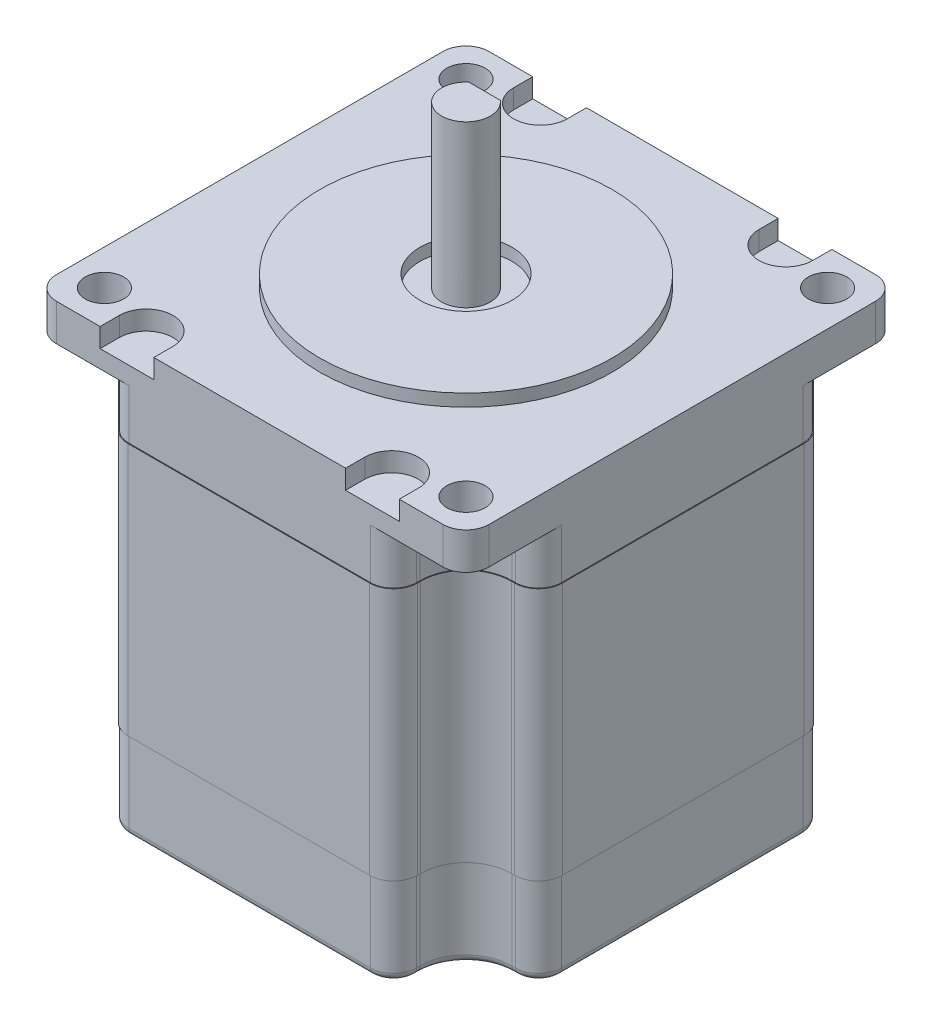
SolidWorks part; units mm, degrees
ref_plane "Front Plane" through (0, 0, 0) normal (0, 0, 1) x (1, 0, 0)
ref_plane "Top Plane" through (0, 0, 0) normal (0, 1, 0) x (1, 0, 0)
ref_plane "Right Plane" through (0, 0, 0) normal (1, 0, 0) x (0, 0, -1)
sketch "Sketch1" plane through (0, 0, 0) normal (0, 1, 0) x (1, 0, 0)
  line L5 (-28.2, 28.2) -> (28.2, 28.2)
  line L6 (-28.2, 28.2) -> (-28.2, -28.2)
  line L7 (-28.2, -28.2) -> (28.2, -28.2)
  line L8 (28.2, 28.2) -> (28.2, -28.2)
  line L9 (-28.2, 28.2) -> (28.2, -28.2) construction
  line L10 (-28.2, -28.2) -> (28.2, 28.2) construction
  point P0 (0, 0)
  dimension "D1" = 56.4
extrude "Boss-Extrude1" add sketch "Sketch1" along normal mid plane 55.8
sketch "Sketch2" plane through (0, 27.9, 0) normal (0, -1, 0) x (1, 0, 0)
  line L0 (-18.75, 28.2) -> (-18.75, 24.75)
  line L1 (-28.2, 28.2) -> (28.2, 28.2) construction
  line L2 (-24.75, 18.75) -> (-28.2, 18.75)
  line L3 (-28.2, -28.2) -> (-28.2, 28.2) construction
  line L4 (0, 0) -> (0, 28.2) construction
  line L5 (-18.75, 28.2) -> (-28.2, 28.2)
  line L6 (-28.2, 28.2) -> (-28.2, 18.75)
  line L7 (28.2, 28.2) -> (28.2, 18.75)
  line L8 (18.75, 28.2) -> (28.2, 28.2)
  line L9 (24.75, 18.75) -> (28.2, 18.75)
  line L10 (18.75, 28.2) -> (18.75, 24.75)
  line L11 (0, 0) -> (28.2, 0) construction
  line L12 (28.2, 28.2) -> (28.2, -28.2) construction
  line L13 (18.75, -28.2) -> (18.75, -24.75)
  line L14 (24.75, -18.75) -> (28.2, -18.75)
  line L15 (18.75, -28.2) -> (28.2, -28.2)
  line L16 (28.2, -28.2) -> (28.2, -18.75)
  line L17 (-28.2, -28.2) -> (-28.2, -18.75)
  line L18 (-18.75, -28.2) -> (-28.2, -28.2)
  line L19 (-24.75, -18.75) -> (-28.2, -18.75)
  line L20 (-18.75, -28.2) -> (-18.75, -24.75)
  arc A0 (-18.75, 24.75) -> (-24.75, 18.75) centre (-24.75, 24.75) cw
  arc A1 (18.75, 24.75) -> (24.75, 18.75) centre (24.75, 24.75) ccw
  arc A2 (18.75, -24.75) -> (24.75, -18.75) centre (24.75, -24.75) cw
  arc A3 (-18.75, -24.75) -> (-24.75, -18.75) centre (-24.75, -24.75) ccw
  dimension "D1" = 37.5
  dimension "D3" = 6
  dimension "D2" = 18.75
extrude "Cut-Extrude1" cut sketch "Sketch2" along normal through all from offset 4.8
fillet "Fillet1" radius 3 12 edges at (-28.2, -2.4, -18.75) (-28.2, -2.4, 18.75) (18.75, -2.4, 28.2) (28.2, -2.4, 18.75) (28.2, -2.4, -18.75) (18.75, -2.4, -28.2) (-18.75, -2.4, -28.2) (-18.75, -2.4, 28.2) (28.2, 25.5, 28.2) (-28.2, 25.5, -28.2) (28.2, 25.5, -28.2) (-28.2, 25.5, 28.2)
fillet "Fillet2" radius 1 24 edges at (-17.8713, -27.9, 27.3213) (-18.75, -27.9, 24.975) (-20.5074, -27.9, 20.5074) (-24.975, -27.9, 18.75) (-27.3213, -27.9, 17.8713) (-28.2, -27.9, 0) (-27.3213, -27.9, -17.8713) (-24.975, -27.9, -18.75) (-20.5074, -27.9, -20.5074) (-18.75, -27.9, -24.975) (-17.8713, -27.9, -27.3213) (0, -27.9, -28.2) (17.8713, -27.9, -27.3213) (18.75, -27.9, -24.975) (20.5074, -27.9, -20.5074) (24.975, -27.9, -18.75) (27.3213, -27.9, -17.8713) (28.2, -27.9, 0) (27.3213, -27.9, 17.8713) (24.975, -27.9, 18.75) (20.5074, -27.9, 20.5074) (18.75, -27.9, 24.975) (17.8713, -27.9, 27.3213) (0, -27.9, 28.2)
sketch "Sketch3" plane through (0, 27.9, 0) normal (0, 1, 0) x (1, 0, 0)
  line L0 (0, 0) -> (0, 23.57) construction
  line L1 (-23.57, 23.57) -> (23.57, 23.57) construction
  line L2 (-23.57, 23.57) -> (-23.57, -23.57) construction
  line L3 (-23.57, -23.57) -> (23.57, -23.57) construction
  line L4 (23.57, 23.57) -> (23.57, -23.57) construction
  line L5 (-23.57, 23.57) -> (23.57, -23.57) construction
  line L6 (-23.57, -23.57) -> (23.57, 23.57) construction
  line L7 (0, 0) -> (23.57, 0) construction
  circle A0 centre (23.57, 23.57) radius 2.5
  circle A1 centre (-23.57, 23.57) radius 2.5
  circle A2 centre (23.57, -23.57) radius 2.5
  circle A3 centre (-23.57, -23.57) radius 2.5
  point P0 (0, 0)
  dimension "D2" = 5
  dimension "D1" = 47.14
extrude "Cut-Extrude2" cut sketch "Sketch3" against normal blind 55.8
sketch "Sketch4" plane through (0, 27.9, 0) normal (0, 1, 0) x (1, 0, 0)
  circle A0 centre (0, 0) radius 19.05
  dimension "D1" = 38.1
extrude "Boss-Extrude2" add sketch "Sketch4" along normal blind 1.6
sketch "Sketch5" plane through (0, 27.9, 0) normal (0, 1, 0) x (1, 0, 0)
  circle A0 centre (0, 0) radius 3.175
  dimension "D1" = 6.35
extrude "Boss-Extrude3" add sketch "Sketch5" along normal blind 21
sketch "Sketch6" plane through (0, 48.9, 0) normal (0, 1, 0) x (1, 0, 0)
  line L0 (-2.0494, 2.425) -> (2.0494, 2.425)
  circle A0 centre (0, 0) radius 3.175 construction
  circle A1 centre (0, 0) radius 3.175 construction
  arc A2 (2.0494, 2.425) -> (-2.0494, 2.425) centre (0, 0) ccw
  dimension "D1" = 5.6
extrude "Cut-Extrude3" cut sketch "Sketch6" against normal blind 15
sketch "Sketch7" plane through (0, 0, 0) normal (1, 0, 0) x (0, 0, -1)
  line L0 (2.425, 33.9) -> (3.175, 31.9)
  line L1 (3.175, 29.5) -> (3.175, 33.9) construction
  line L2 (3.175, 31.9) -> (3.175, 33.9)
  line L3 (3.175, 33.9) -> (2.425, 33.9)
  dimension "D1" = 2
extrude "Cut-Extrude4" cut sketch "Sketch7" against normal through all both and the other way through all
fillet "Fillet3" radius 5 1 edges at (0, 33.9, -2.425)
sketch "Sketch8" plane through (0, 29.5, 0) normal (0, 1, 0) x (1, 0, 0)
  circle A0 centre (0, 0) radius 3.175 construction
  circle A1 centre (0, 0) radius 3.175
  circle A2 centre (0, 0) radius 6
  dimension "D1" = 12
extrude "Cut-Extrude5" cut sketch "Sketch8" against normal up to surface (1.6 mm away)
sketch "Sketch9" plane through (0, 27.9, 0) normal (0, 1, 0) x (1, 0, 0)
  line L0 (25.2, 28.2) -> (-25.2, 28.2) construction
  line L2 (-19.5, 28.2) -> (-12.5, 28.2)
  line L3 (-19.5, 28.2) -> (-19.5, 25.7)
  line L5 (-12.5, 28.2) -> (-12.5, 25.7)
  line L6 (0, 0) -> (0, 28.2) construction
  line L7 (12.5, 28.2) -> (12.5, 25.7)
  line L8 (19.5, 28.2) -> (19.5, 25.7)
  line L9 (19.5, 28.2) -> (12.5, 28.2)
  line L10 (0, 0) -> (28.2, 0) construction
  line L11 (28.2, -25.2) -> (28.2, 25.2) construction
  line L12 (19.5, -28.2) -> (12.5, -28.2)
  line L13 (19.5, -28.2) -> (19.5, -25.7)
  line L14 (12.5, -28.2) -> (12.5, -25.7)
  line L15 (-12.5, -28.2) -> (-12.5, -25.7)
  line L16 (-19.5, -28.2) -> (-19.5, -25.7)
  line L17 (-19.5, -28.2) -> (-12.5, -28.2)
  arc A0 (-19.5, 25.7) -> (-12.5, 25.7) centre (-16, 25.7) ccw
  arc A1 (19.5, 25.7) -> (12.5, 25.7) centre (16, 25.7) cw
  arc A2 (19.5, -25.7) -> (12.5, -25.7) centre (16, -25.7) ccw
  arc A3 (-19.5, -25.7) -> (-12.5, -25.7) centre (-16, -25.7) cw
  dimension "D3" = 25
  dimension "D1" = 6
  dimension "D2" = 7
extrude "Cut-Extrude6" cut sketch "Sketch9" against normal blind 2.5
sketch "Sketch10" plane through (0, -27.9, 0) normal (0, -1, 0) x (1, 0, 0)
  line L1 (28.2, -15.75) -> (28.2, 15.75) construction
  line L3 (25.2, 18.75) -> (24.75, 18.75) construction
  line L5 (18.75, 24.75) -> (18.75, 25.2) construction
  line L9 (-28.2, 15.75) -> (-28.2, -15.75) construction
  line L11 (-24.75, 18.75) -> (-25.2, 18.75) construction
  line L13 (-18.75, 25.2) -> (-18.75, 24.75) construction
  line L14 (15.75, 28.2) -> (-15.75, 28.2) construction
  line L17 (28.2, -15.75) -> (28.2, 15.75)
  line L19 (25.2, 18.75) -> (24.75, 18.75)
  line L21 (18.75, 24.75) -> (18.75, 25.2)
  line L25 (-28.2, 15.75) -> (-28.2, -15.75)
  line L27 (-24.75, 18.75) -> (-25.2, 18.75)
  line L29 (-18.75, 25.2) -> (-18.75, 24.75)
  line L30 (15.75, 28.2) -> (-15.75, 28.2)
  line L32 (0, 0) -> (28.2, 0) construction
  line L33 (15.75, -28.2) -> (-15.75, -28.2)
  line L34 (-18.75, -25.2) -> (-18.75, -24.75)
  line L35 (-24.75, -18.75) -> (-25.2, -18.75)
  line L36 (18.75, -24.75) -> (18.75, -25.2)
  line L37 (25.2, -18.75) -> (24.75, -18.75)
  line L38 (25.2, 18.85) -> (24.75, 18.85)
  line L39 (18.85, 24.75) -> (18.85, 25.2)
  line L40 (15.75, 28.3) -> (-15.75, 28.3)
  line L41 (-18.85, 25.2) -> (-18.85, 24.75)
  line L42 (-24.75, 18.85) -> (-25.2, 18.85)
  line L43 (-28.3, 15.75) -> (-28.3, -15.75)
  line L44 (-24.75, -18.85) -> (-25.2, -18.85)
  line L45 (-18.85, -25.2) -> (-18.85, -24.75)
  line L46 (15.75, -28.3) -> (-15.75, -28.3)
  line L47 (18.85, -24.75) -> (18.85, -25.2)
  line L48 (25.2, -18.85) -> (24.75, -18.85)
  line L49 (28.3, -15.75) -> (28.3, 15.75)
  arc A0 (28.2, 15.75) -> (25.2, 18.75) centre (25.2, 15.75) ccw construction
  arc A2 (18.75, 24.75) -> (24.75, 18.75) centre (24.75, 24.75) ccw construction
  arc A4 (18.75, 25.2) -> (15.75, 28.2) centre (15.75, 25.2) ccw construction
  arc A7 (-25.2, 18.75) -> (-28.2, 15.75) centre (-25.2, 15.75) ccw construction
  arc A9 (-24.75, 18.75) -> (-18.75, 24.75) centre (-24.75, 24.75) ccw construction
  arc A10 (-15.75, 28.2) -> (-18.75, 25.2) centre (-15.75, 25.2) ccw construction
  arc A12 (28.2, 15.75) -> (25.2, 18.75) centre (25.2, 15.75) ccw
  arc A14 (18.75, 24.75) -> (24.75, 18.75) centre (24.75, 24.75) ccw
  arc A16 (18.75, 25.2) -> (15.75, 28.2) centre (15.75, 25.2) ccw
  arc A19 (-25.2, 18.75) -> (-28.2, 15.75) centre (-25.2, 15.75) ccw
  arc A21 (-24.75, 18.75) -> (-18.75, 24.75) centre (-24.75, 24.75) ccw
  arc A22 (-15.75, 28.2) -> (-18.75, 25.2) centre (-15.75, 25.2) ccw
  arc A24 (-15.75, -28.2) -> (-18.75, -25.2) centre (-15.75, -25.2) cw
  arc A25 (-24.75, -18.75) -> (-18.75, -24.75) centre (-24.75, -24.75) cw
  arc A26 (-25.2, -18.75) -> (-28.2, -15.75) centre (-25.2, -15.75) cw
  arc A27 (18.75, -25.2) -> (15.75, -28.2) centre (15.75, -25.2) cw
  arc A28 (18.75, -24.75) -> (24.75, -18.75) centre (24.75, -24.75) cw
  arc A29 (28.2, -15.75) -> (25.2, -18.75) centre (25.2, -15.75) cw
  arc A30 (28.3, 15.75) -> (25.2, 18.85) centre (25.2, 15.75) ccw
  arc A31 (18.85, 24.75) -> (24.75, 18.85) centre (24.75, 24.75) ccw
  arc A32 (18.85, 25.2) -> (15.75, 28.3) centre (15.75, 25.2) ccw
  arc A33 (-15.75, 28.3) -> (-18.85, 25.2) centre (-15.75, 25.2) ccw
  arc A34 (-24.75, 18.85) -> (-18.85, 24.75) centre (-24.75, 24.75) ccw
  arc A35 (-25.2, 18.85) -> (-28.3, 15.75) centre (-25.2, 15.75) ccw
  arc A36 (-25.2, -18.85) -> (-28.3, -15.75) centre (-25.2, -15.75) cw
  arc A37 (-24.75, -18.85) -> (-18.85, -24.75) centre (-24.75, -24.75) cw
  arc A38 (-15.75, -28.3) -> (-18.85, -25.2) centre (-15.75, -25.2) cw
  arc A39 (18.85, -25.2) -> (15.75, -28.3) centre (15.75, -25.2) cw
  arc A40 (18.85, -24.75) -> (24.75, -18.85) centre (24.75, -24.75) cw
  arc A41 (28.3, -15.75) -> (25.2, -18.85) centre (25.2, -15.75) cw
  point P0 (28.2, 0)
  dimension "D1" = 0.1
extrude "Boss-Extrude4" add sketch "Sketch10" against normal blind 33 from offset 11.5 separate body
